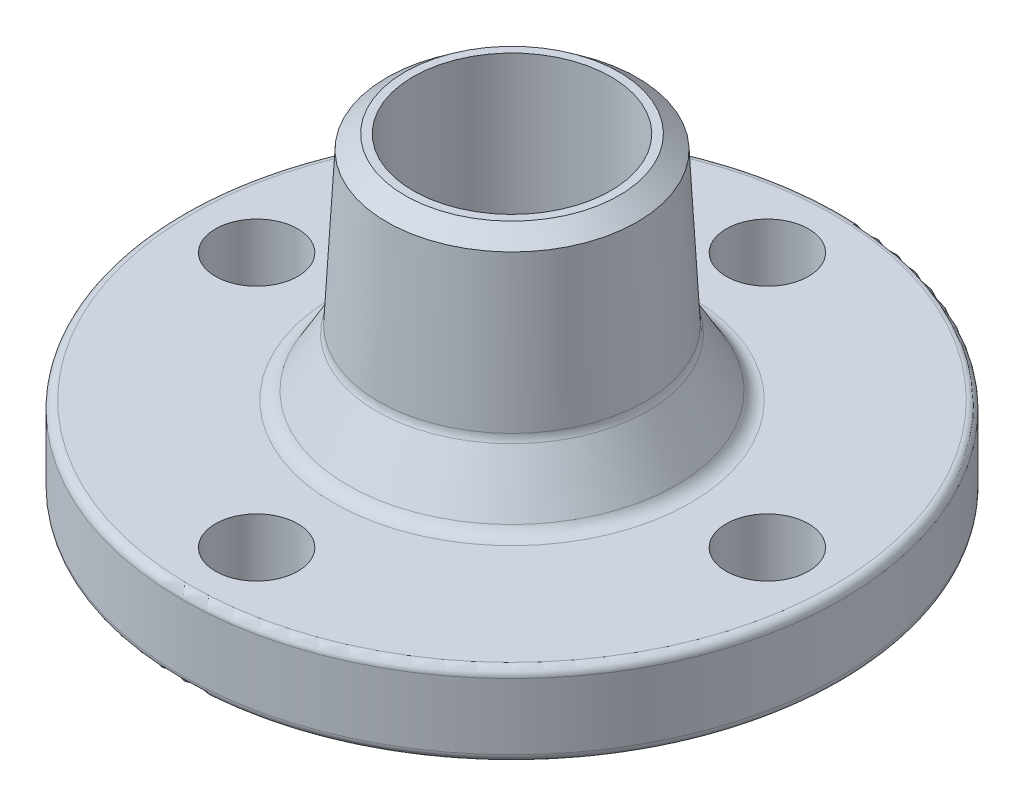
SolidWorks part; units mm, degrees
ref_plane "Front" through (0, 0, 0) normal (0, 0, 1) x (1, 0, 0)
ref_plane "Top" through (0, 0, 0) normal (0, 1, 0) x (1, 0, 0)
ref_plane "Right" through (0, 0, 0) normal (1, 0, 0) x (0, 0, -1)
sketch "Sketch1" plane through (0, 0, 0) normal (0, 0, 1) x (1, 0, 0)
  line L0 (0, 61.9125) -> (0, 0) construction
  line L1 (69.85, 0) -> (-69.85, 0) construction
  line L2 (0, -34.0519) -> (0, 34.0519) construction
  line L3 (19.05, 0) -> (19.05, 61.9125)
  line L4 (19.05, 0) -> (36.5125, 0)
  line L5 (36.5125, 0) -> (36.5125, 1.5875)
  line L6 (36.5125, 1.5875) -> (63.5, 1.5875)
  line L7 (63.5, 1.5875) -> (63.5, 17.4625)
  line L8 (63.5, 17.4625) -> (32.5438, 17.4625)
  line L9 (32.5438, 17.4625) -> (25.7175, 29.2859)
  line L10 (25.7175, 29.2859) -> (24.13, 59.2326)
  line L11 (20.6375, 61.9125) -> (19.05, 61.9125)
  line L12 (24.13, 59.2326) -> (20.6375, 61.9125)
  dimension "O" = 127
  dimension "Q" = 17.4625
  dimension "R" = 73.025
  dimension "X" = 65.0875
  dimension "RAISED FACE" = 1.5875
  dimension "WELD BEVEL" = 37.5
  dimension "D2" = 1.5875
  dimension "H" = 48.26
  dimension "Y" = 61.9125
  dimension "J" = 38.1
  dimension "FLANGE SEAT" = 1.5875
  dimension "D3" = 120
revolve "Revolve1" add sketch "Sketch1" angle 360 about L0
sketch "Sketch2" plane through (0, 1.5875, 0) normal (0, -1, 0) x (1, 0, 0)
  line L0 (34.0519, 0) -> (-34.0519, 0) construction
  circle A0 centre (49.2125, 0) radius 7.9375
  circle A1 centre (0, 0) radius 49.2125 construction
  circle A2 centre (0, 0) radius 63.5 construction
  circle A3 centre (49.2125, 0) radius 6.35 construction
  dimension "BOLT HOLE" = 15.875
  dimension "BOLT CIRCLE" = 98.425
  dimension "BOLT DIAMETER" = 12.7
extrude "Cut-Extrude1" cut sketch "Sketch2" against normal through all
pattern_circular "CirPattern1" count 4 over 360 about axis through (0, 0, 0) along (0, 1, 0) of "Cut-Extrude1"
fillet "Fillet1" radius 3.175 1 edges at (-32.5437, 17.4625, 0)
fillet "Fillet2" radius 3.175 1 edges at (-25.7175, 29.2859, 0)
fillet "Fillet3" radius 1.5875 2 edges at (-63.5, 17.4625, 0) (-63.5, 1.5875, 0)
fillet "Fillet4" radius 1.5875 1 edges at (-36.5125, 1.5875, 0)
